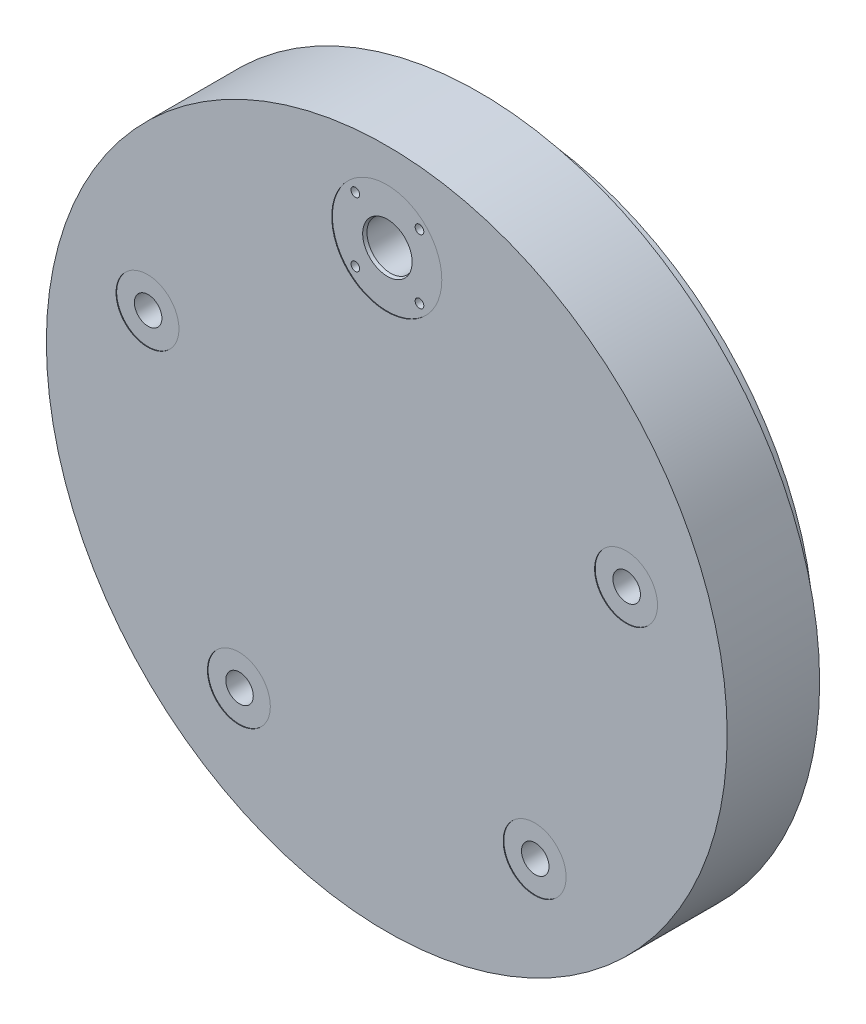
SolidWorks part; units mm, degrees
ref_plane "Front Plane" through (0, 0, 0) normal (0, 0, 1) x (1, 0, 0)
ref_plane "Top Plane" through (0, 0, 0) normal (0, 1, 0) x (1, 0, 0)
ref_plane "Right Plane" through (0, 0, 0) normal (1, 0, 0) x (0, 0, -1)
sketch "Sketch1" plane through (0, 0, 0) normal (1, 0, 0) x (0, 0, -1)
  line L0 (0, 0) -> (0, 1.6279)
  line L1 (0, 137.4775) -> (0, 0)
  line L2 (0, 137.4775) -> (37.338, 137.4775)
  line L3 (37.338, 137.4775) -> (37.338, 122.555)
  line L4 (37.338, 122.555) -> (50.038, 122.555)
  line L5 (0, 0) -> (50.038, 0)
  line L6 (50.038, 122.555) -> (50.038, 0)
  dimension "D1" = 137.4775
  dimension "D2" = 37.338
  dimension "D3" = 12.7
  dimension "D4" = 122.555
revolve "Revolve1" add sketch "Sketch1" angle 360 about L5
hole_wizard "7/16-20 Tapped Hole1" positions "Sketch3" profile "Sketch2" tap size "7/16-20" standard "Ansi Inch"
sketch "Sketch3" plane through (0, 0, 0) normal (0, 0, 1) x (1, 0, 0)
  line L0 (0, 0) -> (-96.6273, 31.3961)
  line L4 (0, 0) -> (96.6273, 31.3961)
  line L7 (-59.719, -82.1961) -> (0, 0)
  line L9 (59.719, -82.1961) -> (0, 0)
  line L11 (0, 0) -> (0, 99.4901)
  line L12 (0, 0) -> (0, -114.2779) construction
  point P0 (-96.6273, 31.3961)
  point P3 (96.6273, 31.3961)
  point P22 (-59.719, -82.1961)
  point P24 (59.719, -82.1961)
  dimension "D1" = 36
  dimension "D2" = 36
  dimension "D3" = 101.6
  dimension "D4" = 72
  dimension "D5" = 101.6
  dimension "D6" = 72
  dimension "D7" = 101.6
  dimension "D8" = 101.6
sketch "Sketch2" plane through (-96.6273, 31.3961, 0) normal (1, 0, 0) x (0, -1, 0)
  line L0 (0, 0) -> (0, 50.038)
  line L1 (0, 50.038) -> (5.5562, 50.038)
  line L2 (5.5562, 50.038) -> (5.5562, 0)
  line L5 (5.5562, 0) -> (0, 0)
  line L11 (0, -6.35) -> (0, 107.95) construction
  dimension "Thread Major Dia." = 11.1125
  dimension "Thru Tap Drill Depth" = 50.038
sketch "Sketch4" plane through (0, 0, 0) normal (0, 0, 1) x (1, 0, 0)
  line L0 (0, -27.5209) -> (0, 27.5209) construction
  circle A0 centre (0, 101.6) radius 9.525
  dimension "D1" = 19.05
  dimension "D2" = 101.6
extrude "Cut-Extrude1" cut sketch "Sketch4" against normal through all
hole_wizard "#6-32 Tapped Hole1" positions "Sketch6" profile "Sketch5" tap size "#6-32" standard "Ansi Inch"
sketch "Sketch6" plane through (0, 0, 0) normal (0, 0, 1) x (1, 0, 0)
  circle A0 centre (0, 101.6) radius 9.525 construction
  point P0 (-12.954, 114.554)
  point P1 (12.954, 114.554)
  point P3 (-12.954, 88.646)
  point P5 (12.954, 88.646)
  dimension "D1" = 12.954
  dimension "D2" = 12.954
  dimension "D3" = 12.954
  dimension "D4" = 12.954
sketch "Sketch5" plane through (-12.954, 114.554, 0) normal (1, 0, 0) x (0, -1, 0)
  line L0 (0, 0) -> (0, 15.2907)
  line L1 (0, 15.2907) -> (1.3525, 14.478)
  line L2 (1.3525, 14.478) -> (1.3525, 7.0104)
  line L3 (1.3525, 7.0104) -> (1.7526, 7.0104)
  line L4 (1.7526, 7.0104) -> (1.7526, 0)
  line L5 (1.7526, 0) -> (0, 0)
  line L10 (0, 15.2907) -> (-1.3526, 14.478) construction
  line L11 (0, -6.35) -> (0, 107.95) construction
  dimension "Tap Drill Dia." = 2.7051
  dimension "Tap Drill Depth" = 14.478
  dimension "Thread Major Dia." = 3.5052
  dimension "Thread Depth" = 7.0104
  dimension "Drill Angle" = 118
sketch "Sketch7" plane through (0, 0, 0) normal (0, 0, 1) x (1, 0, 0)
  circle A0 centre (0, 101.6) radius 22.225
  circle A1 centre (-59.719, -82.1961) radius 12.7
  circle A2 centre (59.719, -82.1961) radius 12.7
  circle A3 centre (96.6273, 31.3961) radius 12.7
  circle A4 centre (-96.6273, 31.3961) radius 12.7
  dimension "D1" = 44.45
  dimension "D2" = 25.4
  dimension "D3" = 25.4
  dimension "D4" = 25.4
  dimension "D5" = 25.4
extrude "Cut-Extrude2" cut sketch "Sketch7" against normal blind 0.254
chamfer "Chamfer1" distance 1.27 angle 20 1 edges at (9.525, 101.6, -0.254)
